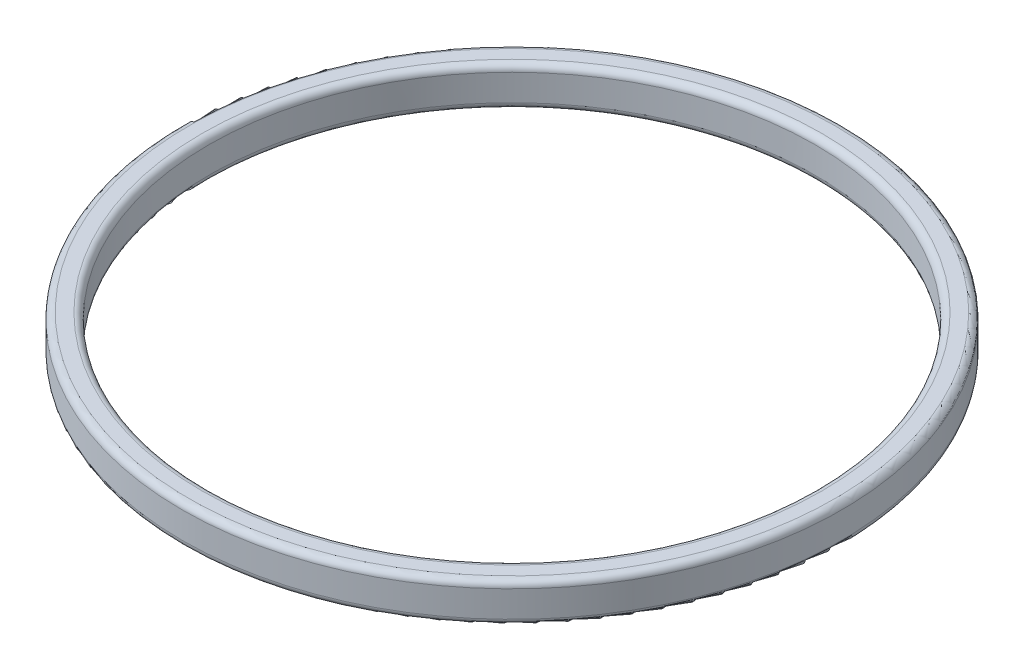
SolidWorks part; units mm, degrees
ref_plane "Plan1" through (0, 0, 0) normal (0, 0, 1) x (1, 0, 0)
ref_plane "Plan2" through (0, 0, 0) normal (0, 1, 0) x (1, 0, 0)
ref_plane "Plan3" through (0, 0, 0) normal (1, 0, 0) x (0, 0, -1)
sketch "Esquisse1" plane through (0, 0, 0) normal (0, 0, 1) x (1, 0, 0)
  line L0 (0, 20) -> (0, -20) construction
  line L2 (11.5, 0) -> (12.5, 0)
  line L3 (11.5, 0) -> (11.5, 1.5)
  line L4 (11.5, 1.5) -> (12.5, 1.5)
  line L5 (12.5, 0) -> (12.5, 1.5)
  dimension "D1" = 1.5
  dimension "D2" = 11.5
  dimension "D3" = 12.5
revolve "Base-Révolution" add sketch "Esquisse1" angle 360 about L0
fillet "Congé1" radius 0.25
